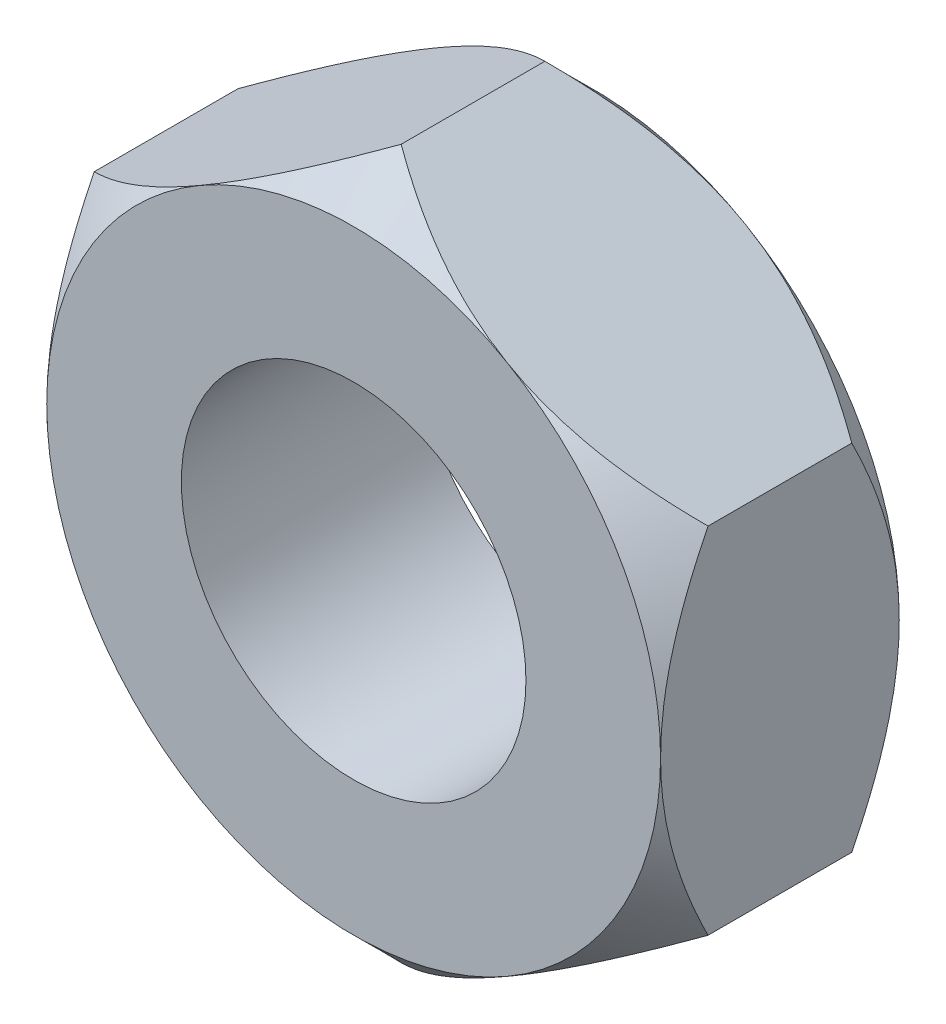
SolidWorks part; units mm, degrees
ref_plane "Front" through (0, 0, 0) normal (0, 0, 1) x (1, 0, 0)
ref_plane "Top" through (0, 0, 0) normal (0, 1, 0) x (1, 0, 0)
ref_plane "Right" through (0, 0, 0) normal (1, 0, 0) x (0, 0, -1)
sketch "Sketch1" plane through (0, 0, 0) normal (0, 0, 1) x (1, 0, 0)
  line L0 (0, 0) -> (0, 10.3923) construction
  line L1 (0, 0) -> (-9, 0) construction
  line L2 (9, 5.1962) -> (9, -5.1962)
  line L3 (9, 5.1962) -> (0, 10.3923)
  line L4 (-9, 5.1962) -> (0, 10.3923)
  line L5 (-9, 5.1962) -> (-9, -5.1962)
  line L6 (-9, -5.1962) -> (0, -10.3923)
  line L7 (9, -5.1962) -> (0, -10.3923)
  circle A0 centre (0, 0) radius 10.3923 construction
  point P12 (9, 0)
  dimension "D1" = 60
extrude "Base-Extrude" add sketch "Sketch1" along normal mid plane 7
sketch "Sketch3" plane through (0, 0, 0) normal (0, 1, 0) x (1, 0, 0)
  line L1 (-9, 3.5) -> (0, 3.5) construction
  line L3 (-10.3923, 3.5) -> (-9, 3.5)
  line L4 (-9, 3.5) -> (-10.3923, 2.1077)
  line L5 (-10.3923, 2.1077) -> (-10.3923, 3.5)
  line L6 (0, 3.5) -> (0, -3.5) construction
  line L7 (-9, -3.5) -> (0, -3.5) construction
  point P0 (-10.3923, 0)
  dimension "D2" = 45
revolve "Cut-Revolve1" cut sketch "Sketch3" angle 360 about L6
mirror "Mirror1" about plane through (0, 0, 0) normal (0, 0, 1) of "Cut-Revolve1"
sketch "Sketch4" plane through (0, 0, 3.5) normal (0, 0, 1) x (1, 0, 0)
  circle A0 centre (0, 0) radius 5.053
  dimension "d" = 10.106
extrude "Cut-Extrude1" cut sketch "Sketch4" against normal through all
